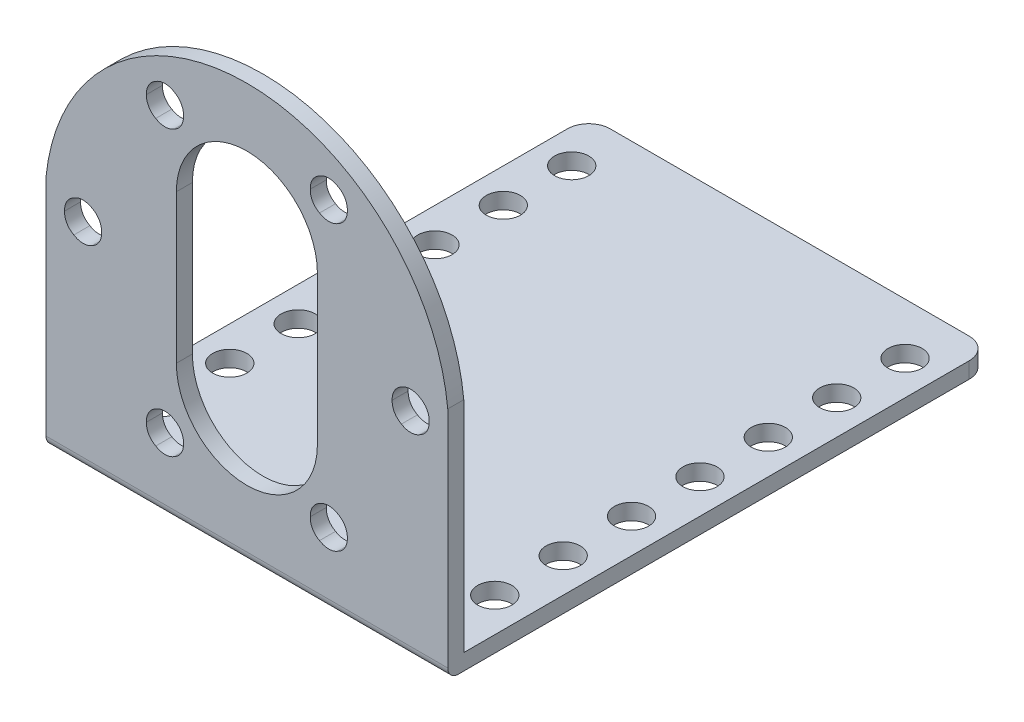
SolidWorks part; units mm, degrees
ref_plane "Front Plane" through (0, 0, 0) normal (0, 0, 1) x (1, 0, 0)
ref_plane "Top Plane" through (0, 0, 0) normal (0, 1, 0) x (1, 0, 0)
ref_plane "Right Plane" through (0, 0, 0) normal (1, 0, 0) x (0, 0, -1)
sketch "Sketch1" plane through (0, 0, 0) normal (0, 0, 1) x (1, 0, 0)
  line L0 (0, 0) -> (0, 39) construction
  line L1 (-18.8, 0) -> (18.8, 0)
  line L2 (-18.8, 0) -> (-18.8, 22)
  line L4 (18.8, 0) -> (18.8, 22)
  line L6 (-6.6, 12.9994) -> (-6.6, 26.8994)
  line L8 (6.6, 12.9994) -> (6.6, 26.8994)
  arc A0 (-18.8, 22) -> (18.8, 22) centre (0, 20.1047) cw
  arc A1 (-6.6, 26.8994) -> (6.6, 26.8994) centre (0, 26.9) cw
  arc A2 (-6.6, 12.9994) -> (6.6, 12.9994) centre (0, 13) ccw
  dimension "D3" = 39
  dimension "D5" = 27.1
  dimension "D6" = 5.5
  dimension "D1" = 37.6
  dimension "D2" = 22
  dimension "D4" = 13.2
  dimension "D7" = 13.9
extrude "Boss-Extrude1" add sketch "Sketch1" along normal blind 1.5
sketch "Sketch2" plane through (0, 0, 0) normal (0, -1, 0) x (1, 0, 0)
  line L0 (18.8, 1.5) -> (18.8, 0) construction
  line L1 (-18.8, 1.5) -> (18.8, 1.5)
  line L2 (-18.8, 1.5) -> (-18.8, -49.3)
  line L3 (-18.8, -49.3) -> (18.8, -49.3)
  line L4 (18.8, 1.5) -> (18.8, -49.3)
  dimension "D1" = 50.8
extrude "Boss-Extrude2" add sketch "Sketch2" against normal blind 1.5
fillet "Fillet1" radius 1 1 edges at (0, 0, 1.5)
fillet "Fillet2" radius 2 2 edges at (-18.8, 0.75, -49.3) (18.8, 0.75, -49.3)
sketch "Sketch3" plane through (0, 0, 0) normal (0, -1, 0) x (1, 0, 0)
  line L0 (-16.8, -49.3) -> (16.8, -49.3) construction
  line L1 (-18.8, 0.5) -> (-18.8, -47.3) construction
  circle A0 centre (-15.6, -44.5) radius 1.6
  dimension "D1" = 3.2
  dimension "D2" = 4.8
  dimension "D3" = 3.2
extrude "Cut-Extrude1" cut sketch "Sketch3" against normal up to next
pattern_linear "LPattern1" count 7 spacing 6.4 along (0, 0, 1) of "Cut-Extrude1"
mirror "Mirror1" about plane through (0, 0, 0) normal (1, 0, 0) of "LPattern1", "Cut-Extrude1"
sketch "Sketch4" plane through (0, 0, 1.5) normal (0, 0, 1) x (1, 0, 0)
  line L0 (0, 0) -> (0, 39) construction
  line L1 (-7.6648, 33.2258) -> (-5.815, 30.0218) construction
  line L2 (-5.815, 30.0218) -> (0, 19.95) construction
  line L3 (0, 19.95) -> (-5.815, 9.8782) construction
  line L4 (0, 19.95) -> (5.815, 9.8782) construction
  line L5 (5.815, 9.8782) -> (7.6648, 6.6742) construction
  line L6 (0, 19.95) -> (5.815, 30.0218) construction
  line L7 (5.815, 30.0218) -> (7.6648, 33.2258) construction
  line L8 (-5.815, 9.8782) -> (-7.6648, 6.6742) construction
  line L9 (7.325, 33.2258) -> (7.6648, 33.2258) construction
  line L10 (7.6648, 33.2258) -> (9.5146, 36.4297) construction
  circle A0 centre (7.6648, 33.2258) radius 1.6
  arc A1 (18.8, 22) -> (-18.8, 22) centre (0, 20.1047) ccw construction
  circle A3 centre (15.3295, 19.95) radius 1.6
  circle A4 centre (7.6648, 6.6742) radius 1.6
  circle A5 centre (-7.6648, 6.6742) radius 1.6
  circle A6 centre (-15.3295, 19.95) radius 1.6
  circle A7 centre (-7.6648, 33.2258) radius 1.6
  arc A8 (-6.6, 12.9994) -> (6.6, 12.9994) centre (0, 13) ccw construction
  arc A9 (6.6, 26.8994) -> (-6.6, 26.8994) centre (0, 26.9) ccw construction
  point P26 (0, 19.95)
  dimension "D1" = 3.2
  dimension "D2" = 6
extrude "Cut-Extrude2" cut sketch "Sketch4" against normal up to next
pattern_circular "CirPattern1" count 6 over 360 about axis through (0, 20.1047, 0) along (0, 0, 1) of "Cut-Extrude2"
